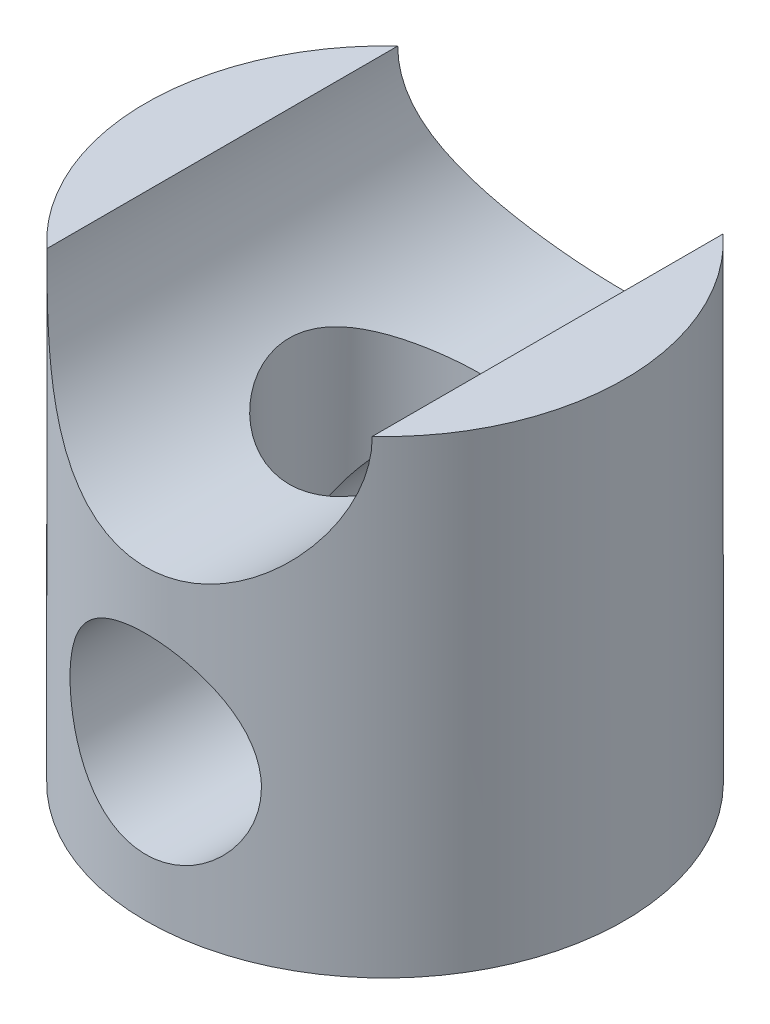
SolidWorks part; units mm, degrees
ref_plane "前视基准面" through (0, 0, 0) normal (0, 0, 1) x (1, 0, 0)
ref_plane "上视基准面" through (0, 0, 0) normal (0, 1, 0) x (1, 0, 0)
ref_plane "右视基准面" through (0, 0, 0) normal (1, 0, 0) x (0, 0, -1)
sketch "草图1" plane through (0, 0, 0) normal (0, 1, 0) x (1, 0, 0)
  circle A0 centre (0, 0) radius 100
extrude "拉伸1" add sketch "草图1" along normal blind 196
sketch "草图2" plane through (0, 0, 0) normal (0, 0, 1) x (1, 0, 0)
  line L0 (100, 196) -> (-100, 196) construction
  line L1 (68, 196) -> (-68, 196)
  arc A0 (-68, 196) -> (68, 196) centre (0, 196) ccw
extrude "切除-拉伸1" cut sketch "草图2" against normal through all and the other way through all
sketch "草图3" plane through (0, 0, 0) normal (0, 0, 1) x (1, 0, 0)
  circle A0 centre (0, 64) radius 40
  dimension "D1" = 64
extrude "切除-拉伸2" cut sketch "草图3" against normal through all and the other way through all
sketch "草图4" plane through (0, 196, 0) normal (0, 1, 0) x (1, 0, 0)
  circle A0 centre (0, 0) radius 40
extrude "切除-拉伸3" cut sketch "草图4" against normal through all
